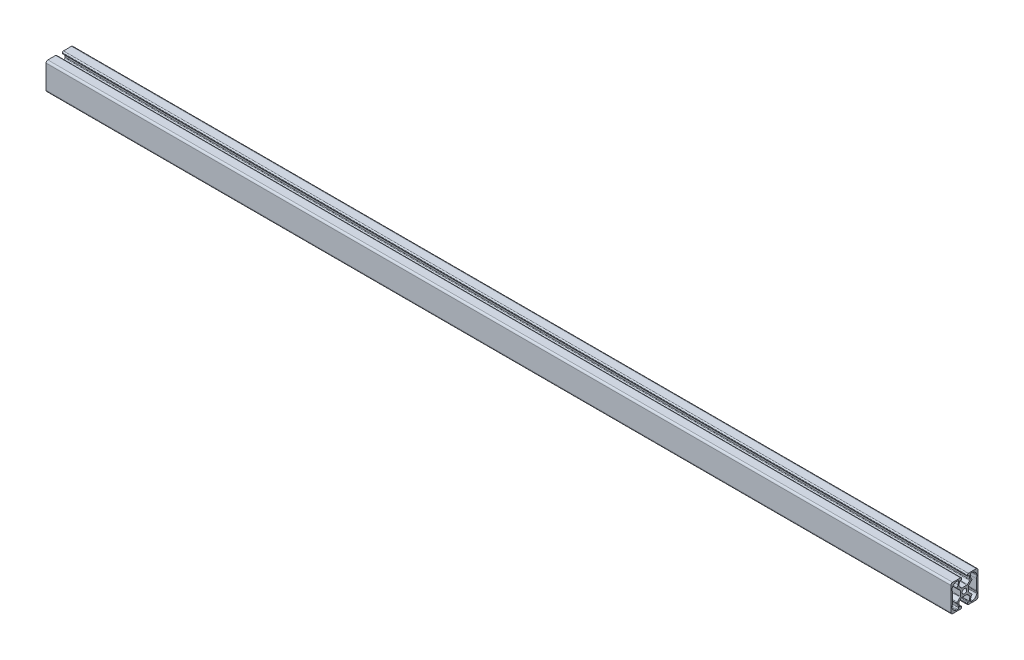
SolidWorks part; units mm, degrees
ref_plane "正面" through (0, 0, 0) normal (0, 0, 1) x (1, 0, 0)
ref_plane "平面" through (0, 0, 0) normal (0, 1, 0) x (1, 0, 0)
ref_plane "右側面" through (0, 0, 0) normal (1, 0, 0) x (0, 0, -1)
sketch "ｽｹｯﾁ1" plane through (0, 0, 0) normal (1, 0, 0) x (0, 0, -1)
  line L0 (2.6716, 4.5) -> (-2.6716, 4.5)
  line L1 (2.6716, -4.5) -> (-2.6716, -4.5)
  line L2 (-13.1, -5.7576) -> (-13.1, 5.7576)
  line L3 (-4.7929, 3.3787) -> (-7.8787, 6.4645)
  line L4 (-15, -13) -> (-15, 13)
  line L5 (-13, -15) -> (-4.35, -15)
  line L6 (-6.0721, -8.0894) -> (-5.3672, -12.0868)
  line L7 (-3.9, -12.5) -> (-4.8748, -12.5)
  line L8 (-3.15, -13.8) -> (-3.15, -13.25)
  line L9 (-4.7929, -3.3787) -> (-7.8787, -6.4645)
  line L10 (-3.3787, -4.7929) -> (-5.7944, -7.2086)
  line L11 (-4.5, -2.6716) -> (-4.5, 2.6716)
  line L12 (-13, 15) -> (-4.35, 15)
  line L13 (-13.7, 8.9007) -> (-13.7, 7.8648)
  line L14 (-8.9007, 13.7) -> (-7.4931, 13.7)
  line L15 (-3.9, 12.5) -> (-4.8748, 12.5)
  line L16 (-3.3787, 4.7929) -> (-5.7944, 7.2086)
  line L17 (-6.0721, 8.0894) -> (-5.3672, 12.0868)
  line L18 (-3.15, 13.8) -> (-3.15, 13.25)
  line L19 (-7.0456, 9.4791) -> (-6.5083, 12.5264)
  line L20 (15, -13) -> (15, 13)
  line L21 (4.7929, 3.3787) -> (7.8787, 6.4645)
  line L22 (13.1, -5.7576) -> (13.1, 5.7576)
  line L23 (13.7, -8.9007) -> (13.7, -7.8648)
  line L24 (13, -15) -> (4.35, -15)
  line L25 (3.15, -13.8) -> (3.15, -13.25)
  line L26 (3.9, -12.5) -> (4.8748, -12.5)
  line L27 (6.0721, -8.0894) -> (5.3672, -12.0868)
  line L28 (7.0456, -9.4791) -> (6.5083, -12.5264)
  line L29 (8.9007, -13.7) -> (7.4931, -13.7)
  line L30 (4.5, -2.6716) -> (4.5, 2.6716)
  line L31 (3.3787, -4.7929) -> (5.7944, -7.2086)
  line L32 (4.7929, -3.3787) -> (7.8787, -6.4645)
  line L33 (13, 15) -> (4.35, 15)
  line L34 (7.0456, 9.4791) -> (6.5083, 12.5264)
  line L35 (3.15, 13.8) -> (3.15, 13.25)
  line L36 (6.0721, 8.0894) -> (5.3672, 12.0868)
  line L37 (3.3787, 4.7929) -> (5.7944, 7.2086)
  line L38 (3.9, 12.5) -> (4.8748, 12.5)
  line L39 (8.9007, 13.7) -> (7.4931, 13.7)
  line L40 (13.7, 8.9007) -> (13.7, 7.8648)
  line L41 (-13.7, -8.9007) -> (-13.7, -7.8648)
  line L42 (-8.9007, -13.7) -> (-7.4931, -13.7)
  line L43 (-7.0456, -9.4791) -> (-6.5083, -12.5264)
  circle A0 centre (0, 0) radius 2.55
  arc A1 (-15, -13) -> (-13, -15) centre (-13, -13) ccw
  arc A2 (-5.7944, -7.2086) -> (-6.0721, -8.0894) centre (-5.0873, -7.9157) ccw
  arc A3 (-5.3672, -12.0868) -> (-4.8748, -12.5) centre (-4.8748, -12) ccw
  arc A4 (-4.35, -15) -> (-3.15, -13.8) centre (-4.35, -13.8) ccw
  arc A5 (-3.15, -13.25) -> (-3.9, -12.5) centre (-3.9, -13.25) ccw
  arc A6 (-4.5, 2.6716) -> (-4.7929, 3.3787) centre (-5.5, 2.6716) ccw
  arc A7 (-4.7929, -3.3787) -> (-4.5, -2.6716) centre (-5.5, -2.6716) ccw
  arc A8 (-2.6716, -4.5) -> (-3.3787, -4.7929) centre (-2.6716, -5.5) ccw
  arc A9 (-13, 15) -> (-15, 13) centre (-13, 13) ccw
  arc A10 (-3.15, 13.8) -> (-4.35, 15) centre (-4.35, 13.8) ccw
  arc A11 (-7.8787, 7.8787) -> (-7.0456, 9.4791) centre (-10, 10) ccw
  arc A12 (-6.5083, 12.5264) -> (-7.4931, 13.7) centre (-7.4931, 12.7) ccw
  arc A13 (-13.1, 5.7576) -> (-13.4, 6.8112) centre (-15.1, 5.7576) ccw
  arc A14 (-13.7, 7.8648) -> (-13.4, 6.8112) centre (-11.7, 7.8648) ccw
  arc A15 (-13.6744, 9.1257) -> (-13.7, 8.9007) centre (-12.7, 8.9007) ccw
  arc A16 (-9.1257, 13.6744) -> (-13.6744, 9.1257) centre (-7.76, 7.76) ccw
  arc A17 (-7.8787, 7.8787) -> (-7.8787, 6.4645) centre (-7.1716, 7.1716) ccw
  arc A18 (-8.9007, 13.7) -> (-9.1257, 13.6744) centre (-8.9007, 12.7) ccw
  arc A19 (-4.8748, 12.5) -> (-5.3672, 12.0868) centre (-4.8748, 12) ccw
  arc A20 (-6.0721, 8.0894) -> (-5.7944, 7.2086) centre (-5.0873, 7.9157) ccw
  arc A21 (-3.9, 12.5) -> (-3.15, 13.25) centre (-3.9, 13.25) ccw
  arc A22 (-3.3787, 4.7929) -> (-2.6716, 4.5) centre (-2.6716, 5.5) ccw
  arc A23 (6.0721, -8.0894) -> (5.7944, -7.2086) centre (5.0873, -7.9157) ccw
  arc A24 (7.8787, -7.8787) -> (7.0456, -9.4791) centre (10, -10) ccw
  arc A25 (9.1257, -13.6744) -> (13.6744, -9.1257) centre (7.76, -7.76) ccw
  arc A26 (3.9, -12.5) -> (3.15, -13.25) centre (3.9, -13.25) ccw
  arc A27 (3.15, -13.8) -> (4.35, -15) centre (4.35, -13.8) ccw
  arc A28 (4.8748, -12.5) -> (5.3672, -12.0868) centre (4.8748, -12) ccw
  arc A29 (8.9007, -13.7) -> (9.1257, -13.6744) centre (8.9007, -12.7) ccw
  arc A30 (6.5083, -12.5264) -> (7.4931, -13.7) centre (7.4931, -12.7) ccw
  arc A31 (13.6744, -9.1257) -> (13.7, -8.9007) centre (12.7, -8.9007) ccw
  arc A32 (13, -15) -> (15, -13) centre (13, -13) ccw
  arc A33 (3.3787, -4.7929) -> (2.6716, -4.5) centre (2.6716, -5.5) ccw
  arc A34 (4.5, -2.6716) -> (4.7929, -3.3787) centre (5.5, -2.6716) ccw
  arc A35 (4.7929, 3.3787) -> (4.5, 2.6716) centre (5.5, 2.6716) ccw
  arc A36 (7.8787, -7.8787) -> (7.8787, -6.4645) centre (7.1716, -7.1716) ccw
  arc A37 (13.1, -5.7576) -> (13.4, -6.8112) centre (15.1, -5.7576) ccw
  arc A38 (13.7, -7.8648) -> (13.4, -6.8112) centre (11.7, -7.8648) ccw
  arc A39 (4.35, 15) -> (3.15, 13.8) centre (4.35, 13.8) ccw
  arc A40 (15, 13) -> (13, 15) centre (13, 13) ccw
  arc A41 (13.6744, 9.1257) -> (9.1257, 13.6744) centre (7.76, 7.76) ccw
  arc A42 (2.6716, 4.5) -> (3.3787, 4.7929) centre (2.6716, 5.5) ccw
  arc A43 (3.15, 13.25) -> (3.9, 12.5) centre (3.9, 13.25) ccw
  arc A44 (5.7944, 7.2086) -> (6.0721, 8.0894) centre (5.0873, 7.9157) ccw
  arc A45 (5.3672, 12.0868) -> (4.8748, 12.5) centre (4.8748, 12) ccw
  arc A46 (9.1257, 13.6744) -> (8.9007, 13.7) centre (8.9007, 12.7) ccw
  arc A47 (7.8787, 6.4645) -> (7.8787, 7.8787) centre (7.1716, 7.1716) ccw
  arc A48 (7.4931, 13.7) -> (6.5083, 12.5264) centre (7.4931, 12.7) ccw
  arc A49 (7.0456, 9.4791) -> (7.8787, 7.8787) centre (10, 10) ccw
  arc A50 (13.7, 8.9007) -> (13.6744, 9.1257) centre (12.7, 8.9007) ccw
  arc A51 (13.4, 6.8112) -> (13.7, 7.8648) centre (11.7, 7.8648) ccw
  arc A52 (13.4, 6.8112) -> (13.1, 5.7576) centre (15.1, 5.7576) ccw
  arc A53 (-7.0456, -9.4791) -> (-7.8787, -7.8787) centre (-10, -10) ccw
  arc A54 (-7.4931, -13.7) -> (-6.5083, -12.5264) centre (-7.4931, -12.7) ccw
  arc A55 (-13.4, -6.8112) -> (-13.1, -5.7576) centre (-15.1, -5.7576) ccw
  arc A56 (-13.4, -6.8112) -> (-13.7, -7.8648) centre (-11.7, -7.8648) ccw
  arc A57 (-13.7, -8.9007) -> (-13.6744, -9.1257) centre (-12.7, -8.9007) ccw
  arc A58 (-13.6744, -9.1257) -> (-9.1257, -13.6744) centre (-7.76, -7.76) ccw
  arc A59 (-7.8787, -6.4645) -> (-7.8787, -7.8787) centre (-7.1716, -7.1716) ccw
  arc A60 (-9.1257, -13.6744) -> (-8.9007, -13.7) centre (-8.9007, -12.7) ccw
extrude "ﾎﾞｽ - 押し出し1" add sketch "ｽｹｯﾁ1" along normal blind 1000
